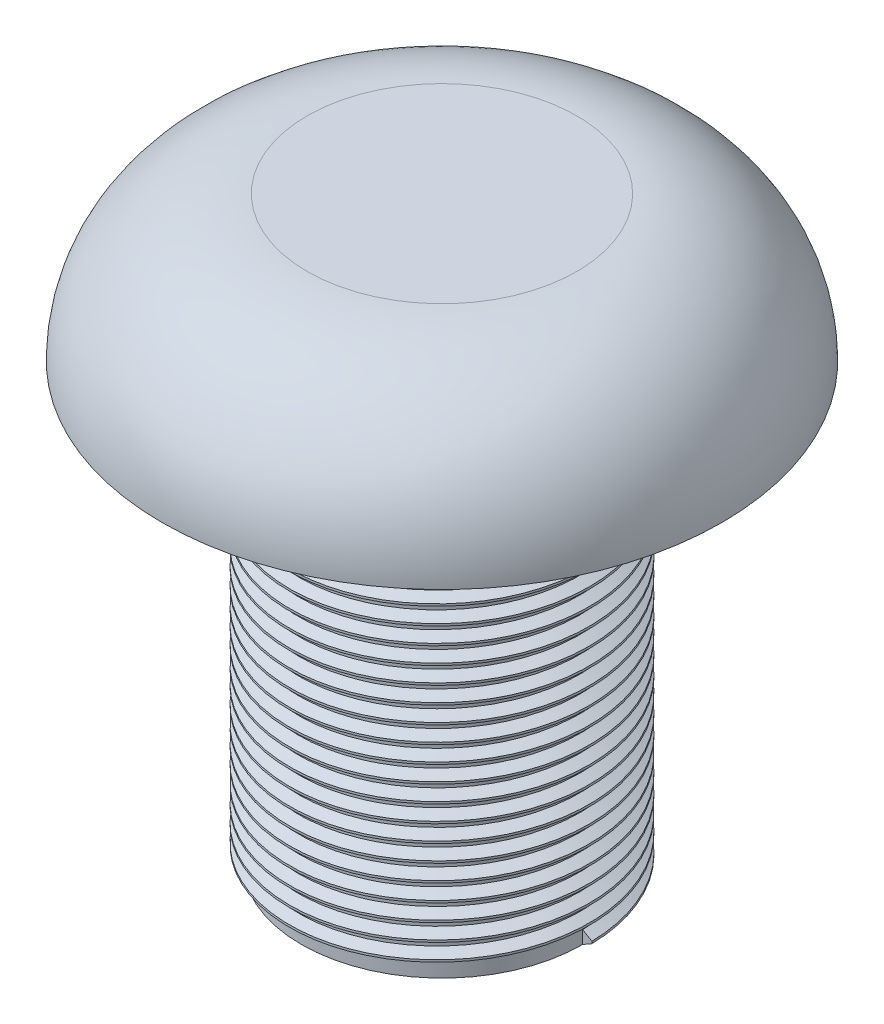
SolidWorks part; units mm, degrees
ref_plane "Front Plane" through (0, 0, 0) normal (0, 0, 1) x (1, 0, 0)
ref_plane "Top Plane" through (0, 0, 0) normal (0, 1, 0) x (1, 0, 0)
ref_plane "Right Plane" through (0, 0, 0) normal (1, 0, 0) x (0, 0, -1)
sketch "Sketch1" plane through (0, 0, 0) normal (0, 1, 0) x (1, 0, 0)
  circle A0 centre (0, 0) radius 24.511
  dimension "D1" = 49.022
extrude "Boss-Extrude2" add sketch "Sketch1" along normal blind 12.7
sketch "Sketch3" plane through (0, 0, 0) normal (0, -1, 0) x (-1, 0, 0)
  circle A0 centre (0, 0) radius 12.319
  dimension "D1" = 24.638
extrude "Boss-Extrude3" add sketch "Sketch3" along normal blind 38.1
fillet "Fillet1" radius 12.7 1 edges at (0, 12.7, 24.511)
thread "Thread2" pitch 1.5 start angle 0, offset 0, length 37.592, pitch 1.5, diameter 24.638
ref_plane "Plane2" through (12.319, -38.1, 0) normal (0, 0, 1) x (1, 0, 0)
sketch "Thread Profile2" plane through (12.319, -38.1, 0) normal (0, 0, 1) x (1, 0, 0)
  line L0 (0, 0) -> (0, 1.5) construction
  line L1 (0, 0) -> (0.8119, 0.4687)
  line L2 (0.8119, 0.4687) -> (0.8119, 0.6562)
  line L3 (0.8119, 0.6562) -> (0, 1.125)
  line L4 (0.8119, 0.5625) -> (0, 0.5625) construction
  line L11 (0, 0) -> (0, 1.125)
  point P2 (0, 0)
  dimension "Pitch" = 1.5
  dimension "Profile_Angle" = 60
  dimension "Profile_Land" = 0.1875
  dimension "Profile_Height" = 0.8119
